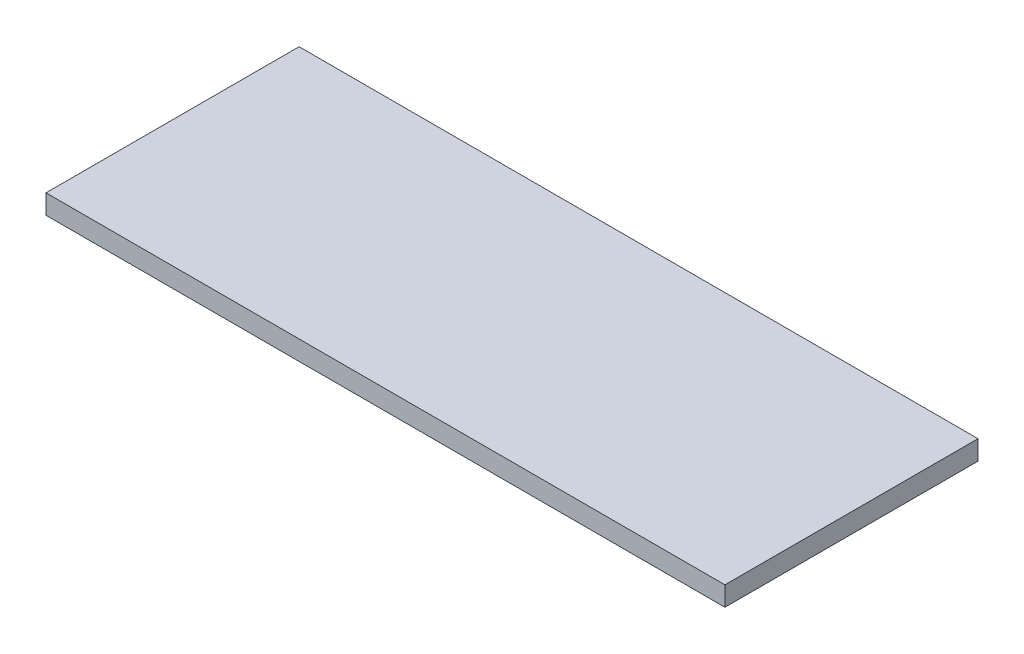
SolidWorks part; units mm, degrees
ref_plane "Plane XZ" through (0, 0, 0) normal (0, 0, 1) x (1, 0, 0)
ref_plane "Plane XY" through (0, 0, 0) normal (0, 1, 0) x (1, 0, 0)
ref_plane "Plane YZ" through (0, 0, 0) normal (1, 0, 0) x (0, 0, -1)
sketch "Sketch1" plane through (0, 0, 0) normal (0, 1, 0) x (1, 0, 0)
  line L0 (-55.3657, 0) -> (55.3657, 0) construction
  line L1 (-55.3656, 20.6375) -> (55.3656, 20.6375)
  line L2 (-55.3656, 20.6375) -> (-55.3656, -20.6375)
  line L3 (-55.3656, -20.6375) -> (55.3656, -20.6375)
  line L4 (55.3656, 20.6375) -> (55.3656, -20.6375)
  dimension "D1" = 41.275
  dimension "D2" = 110.7313
extrude "Boss-Extrude1" add sketch "Sketch1" along normal blind 3.175
